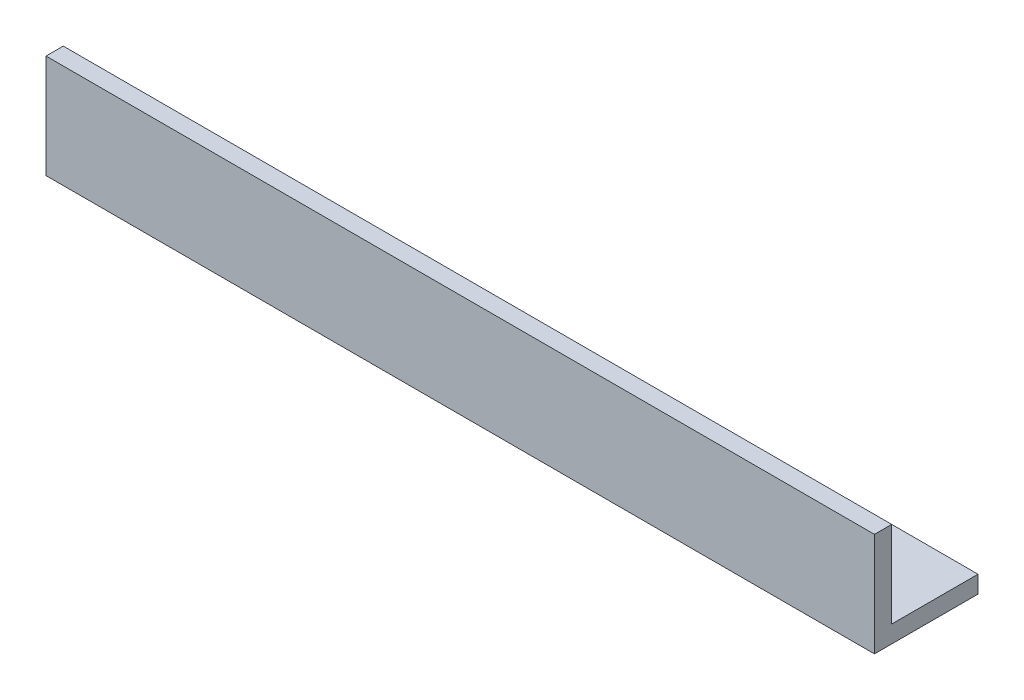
SolidWorks part; units mm, degrees
ref_plane "Front Plane" through (0, 0, 0) normal (0, 0, 1) x (1, 0, 0)
ref_plane "Top Plane" through (0, 0, 0) normal (0, 1, 0) x (1, 0, 0)
ref_plane "Right Plane" through (0, 0, 0) normal (1, 0, 0) x (0, 0, -1)
sketch "Sketch1" plane through (0, 0, 0) normal (1, 0, 0) x (0, 0, -1)
  line L0 (0, 0) -> (0, 38.1)
  line L1 (0, 38.1) -> (6.35, 38.1)
  line L2 (6.35, 38.1) -> (6.35, 6.35)
  line L3 (0, 0) -> (38.1, 0)
  line L4 (38.1, 0) -> (38.1, 6.35)
  line L5 (38.1, 6.35) -> (6.35, 6.35)
  dimension "D1" = 38.1
  dimension "D2" = 38.1
  dimension "D3" = 6.35
  dimension "D4" = 6.35
extrude "Boss-Extrude1" add sketch "Sketch1" along normal blind 304.8
sketch "Sketch2" plane through (0, 0, 0) normal (0, 1, 0) x (1, 0, 0)
  line L0 (0, 0) -> (38.1, 38.1)
  line L1 (304.8, 38.1) -> (0, 38.1) construction
  line L2 (38.1, 38.1) -> (0, 38.1)
  line L3 (0, 38.1) -> (0, 6.35) construction
  line L4 (0, 38.1) -> (0, 0)
  line L5 (304.8, 0) -> (266.7, 38.1)
  line L6 (266.7, 38.1) -> (304.8, 38.1)
  line L7 (304.8, 38.1) -> (304.8, 0)
extrude "Cut-Extrude3" [suppressed] cut sketch "Sketch2" along normal through all
